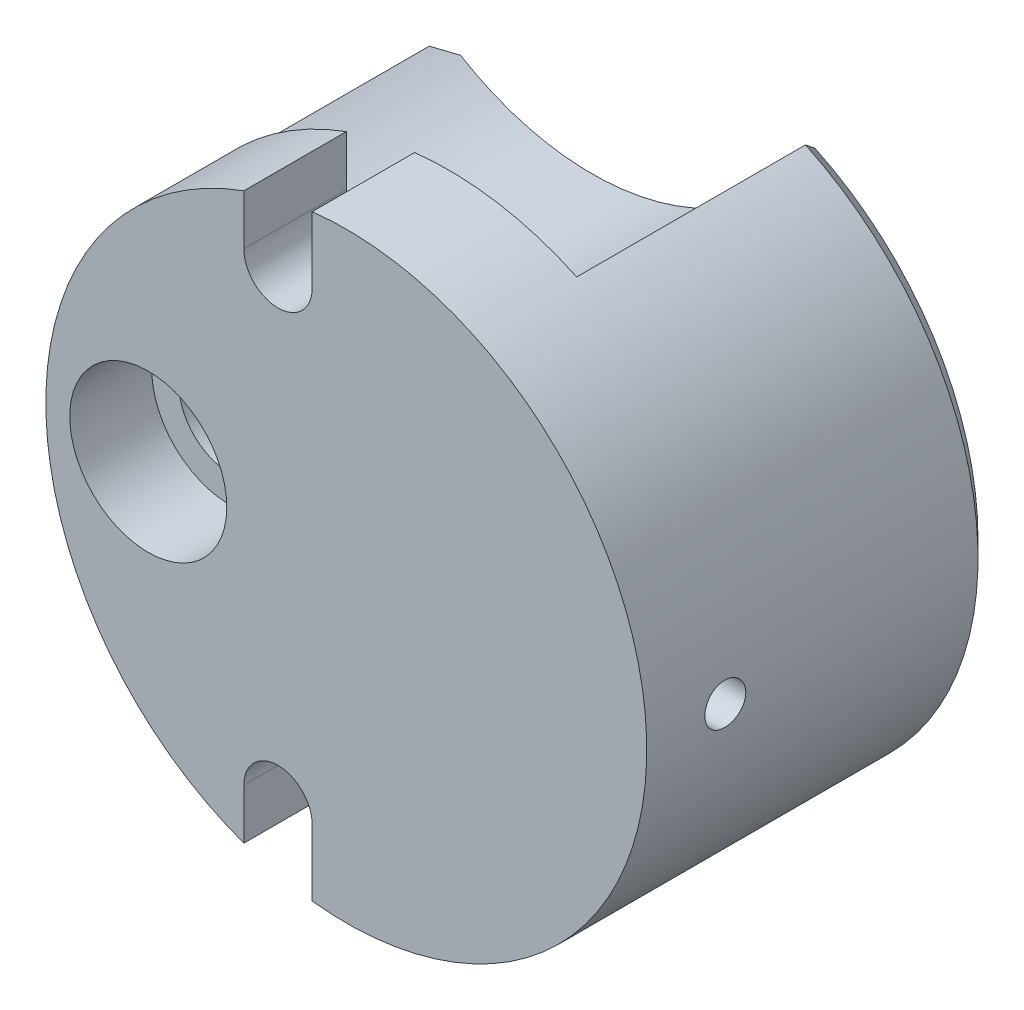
SolidWorks part; units mm, degrees
ref_plane "Face" through (0, 0, 0) normal (0, 0, 1) x (1, 0, 0)
ref_plane "Dessus" through (0, 0, 0) normal (0, 1, 0) x (1, 0, 0)
ref_plane "Droite" through (0, 0, 0) normal (1, 0, 0) x (0, 0, -1)
sketch "Esquisse1" plane through (0, 0, 0) normal (0, 0, 1) x (1, 0, 0)
  circle A0 centre (0, 0) radius 44
  dimension "D1" = 88
extrude "Base-Extrusion" add sketch "Esquisse1" against normal blind 51
sketch "Esquisse2" plane through (0, 0, 0) normal (0, 1, 0) x (1, 0, 0)
  line L0 (16.5, 5) -> (16.5, -56) construction
  line L1 (-5, 51) -> (-5, 45)
  line L3 (-5, 45) -> (-8, 45)
  line L4 (-8, 45) -> (-8, 43)
  line L5 (-8, 43) -> (-3.5, 43)
  line L6 (-3.5, 43) -> (-3.5, 19)
  line L7 (-3.5, 19) -> (-5.5, 19)
  line L8 (-5.5, 19) -> (-5.5, 17)
  line L9 (-5.5, 17) -> (1.5, 17)
  line L10 (1.5, 17) -> (1.5, 7)
  line L11 (1.5, 7) -> (16.5, 7)
  line L12 (-5, 51) -> (16.5, 51)
  line L13 (16.5, 51) -> (16.5, 7)
  line L14 (44, 51) -> (-44, 51) construction
  dimension "D1" = 20
  dimension "D2" = 21.5
  dimension "D3" = 3
  dimension "D4" = 2
  dimension "D5" = 15
  dimension "D6" = 6
  dimension "D7" = 2
  dimension "D8" = 24
  dimension "D9" = 2
  dimension "D10" = 10
  dimension "D11" = 16.5
revolve "Enlèvement de matière-Révolution1" cut sketch "Esquisse2" angle 360 about L0
sketch "Esquisse3" plane through (0, 0, 0) normal (0, 1, 0) x (1, 0, 0)
  line L1 (-29, -25) -> (-29, 66) construction
  line L3 (-29, 51) -> (-29, 0)
  line L4 (-29, 51) -> (-19, 51)
  line L5 (-19, 51) -> (-19, 22)
  line L6 (-19, 22) -> (-21.5, 22)
  line L7 (-21.5, 22) -> (-21.5, 12)
  line L8 (-21.5, 12) -> (-17.5, 12)
  line L10 (-17.5, 12) -> (-17.5, 0)
  line L11 (-17.5, 0) -> (-29, 0)
  line L12 (44, 51) -> (-44, 51) construction
  line L13 (-44, 0) -> (44, 0) construction
  dimension "D1" = 29
  dimension "D2" = 10
  dimension "D3" = 7.5
  dimension "D4" = 11.5
  dimension "D5" = 10
  dimension "D6" = 29
revolve "Enlèvement de matière-Révolution2" cut sketch "Esquisse3" angle 360 about L1
chamfer "Chanfrein1" distance 2.5 angle 45 1 edges at (44, 0, -51)
ref_plane "Plan1" through (44, 0, -24.25) normal (1, 0, 0) x (0, 1, 0)
sketch "Esquisse4" plane through (44, 0, -24.25) normal (1, 0, 0) x (0, 1, 0)
  line L1 (0, -24.25) -> (0, 24.25) construction
  line L2 (44, 24.25) -> (-44, 24.25) construction
  circle A0 centre (0, 12.75) radius 3
  dimension "D1" = 6
  dimension "D2" = 11.5
extrude "Enlèv. mat.-Extru.1" cut sketch "Esquisse4" against normal up to next
sketch "Esquisse5" plane through (0, 0, -51) normal (0, 0, 1) x (1, 0, 0)
  arc A0 (-36.3553, 24.7849) -> (18.7384, 39.8105) centre (-15, 55) ccw
  circle A1 centre (0, 0) radius 44 construction
  arc A3 (18.7384, 39.8105) -> (-36.3553, 24.7849) centre (0, 0) ccw
  arc A4 (18.7384, -39.8105) -> (-36.3553, -24.7849) centre (-15, -55) ccw
  arc A5 (-36.3553, -24.7849) -> (18.7384, -39.8105) centre (0, 0) ccw
  dimension "D1" = 37
  dimension "D4" = 37
  dimension "D2" = 55
  dimension "D3" = 15
  dimension "D5" = 15
  dimension "D6" = 55
extrude "Enlèv. mat.-Extru.4" cut sketch "Esquisse5" along normal blind 36
sketch "Esquisse6" plane through (0, 0, -15) normal (0, 0, -1) x (-1, 0, 0)
  line L0 (15, 41.3642) -> (15, 34)
  line L1 (5, 43.715) -> (5, 34)
  line L2 (15, -34) -> (15, -41.3642)
  line L3 (5, -34) -> (5, -43.715)
  arc A0 (5, 34) -> (15, 34) centre (10, 34) ccw
  circle A1 centre (0, 0) radius 44 construction
  arc A2 (15, 41.3642) -> (5, 43.715) centre (0, 0) ccw
  arc A3 (15, -34) -> (5, -34) centre (10, -34) ccw
  arc A4 (5, -43.715) -> (15, -41.3642) centre (0, 0) ccw
  dimension "D1" = 10
  dimension "D4" = 10
  dimension "D2" = 10
  dimension "D3" = 34
  dimension "D5" = 10
  dimension "D6" = 34
extrude "Enlèv. mat.-Extru.3" cut sketch "Esquisse6" against normal up to next
sketch "Esquisse7" plane through (0, 0, 0) normal (0, 0, 1) x (1, 0, 0)
  line L0 (-44, 0) -> (44, 0)
  arc A0 (-5, -43.715) -> (-5, 43.715) centre (0, 0) ccw construction
  arc A1 (44, 0) -> (-5, 43.715) centre (0, 0) ccw
  arc A2 (-15, 41.3642) -> (-15, -41.3642) centre (0, 0) ccw construction
  arc A3 (-5, 43.715) -> (-44, 0) centre (0, 0) ccw
extrude "Enlèv. mat.-Extru.5" [suppressed] cut sketch "Esquisse7" against normal through all
